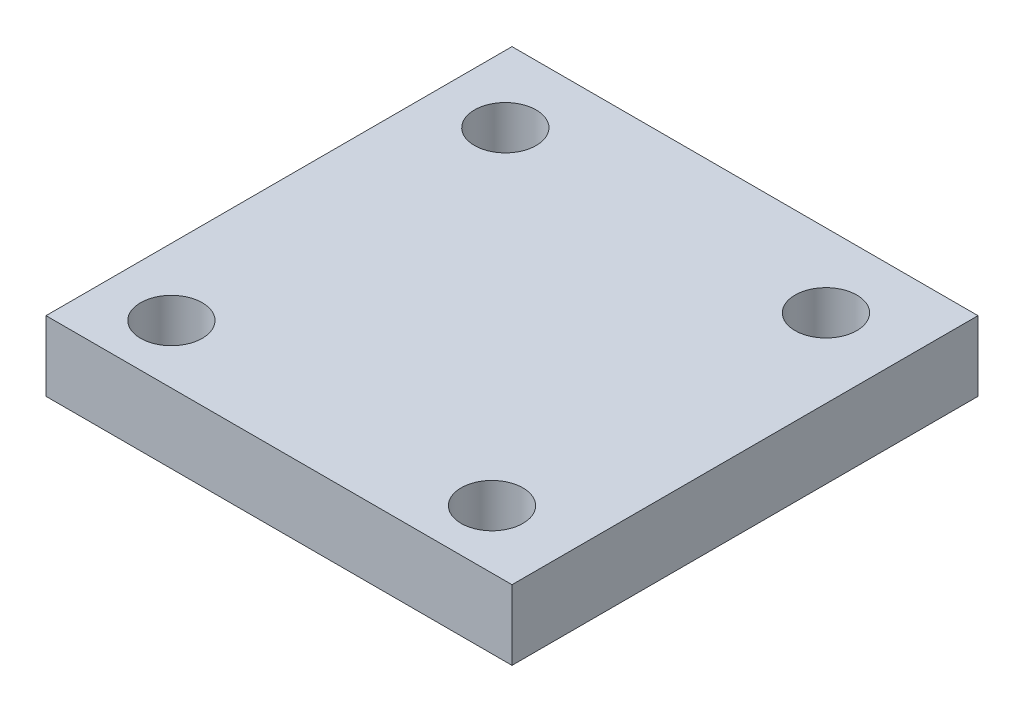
SolidWorks part; units mm, degrees
ref_plane "Front" through (0, 0, 0) normal (0, 0, 1) x (1, 0, 0)
ref_plane "Top" through (0, 0, 0) normal (0, 1, 0) x (1, 0, 0)
ref_plane "Right" through (0, 0, 0) normal (1, 0, 0) x (0, 0, -1)
sketch "Sketch1" plane through (0, 0, 0) normal (0, 1, 0) x (1, 0, 0)
  line L0 (100, -100) -> (-100, 100) construction
  line L1 (-100, 100) -> (100, 100)
  line L2 (-100, 100) -> (-100, -100)
  line L3 (-100, -100) -> (100, -100)
  line L4 (100, 100) -> (100, -100)
  dimension "D1" = 200
extrude "Extrude1" add sketch "Sketch1" along normal blind 30
hole_wizard "M30x3.5 Tapped Hole1" positions "Sketch3" profile "Sketch2" tap size "M30x3.5" standard "Ansi Metric"
sketch "Sketch3" plane through (0, 30, 0) normal (0, 1, 0) x (-1, 0, 0)
  point P0 (71.2788, 74.8999)
  point P1 (-66.3236, 74.8999)
  point P2 (-66.3236, -68.42)
  point P3 (71.2788, -68.42)
sketch "Sketch2" plane through (-71.2788, 30, 74.8999) normal (1, 0, 0) x (0, 0, 1)
  line L0 (0, 0) -> (0, 30)
  line L1 (0, 30) -> (13.25, 30)
  line L2 (13.25, 30) -> (13.25, 0)
  line L5 (13.25, 0) -> (0, 0)
  line L11 (0, -6.35) -> (0, 107.95) construction
  dimension "Thru Tap Drill Dia." = 26.5
  dimension "Thru Tap Drill Depth" = 30
